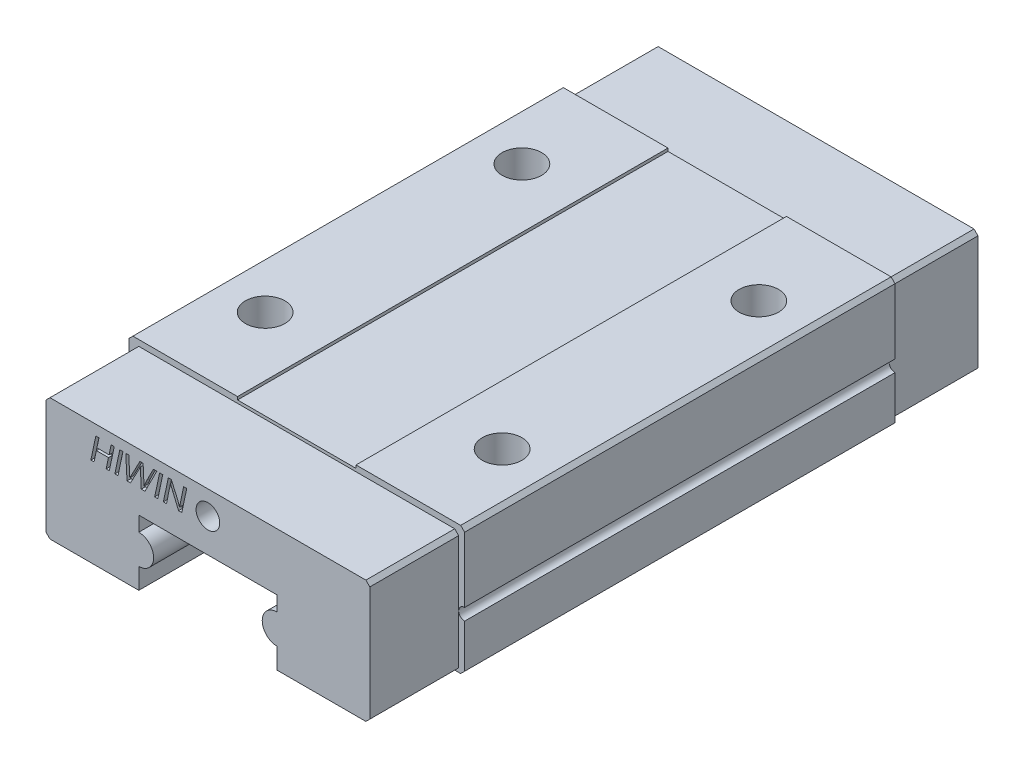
SolidWorks part; units mm, degrees
ref_plane "前视基准面" through (0, 0, 0) normal (0, 0, 1) x (1, 0, 0)
ref_plane "上视基准面" through (0, 0, 0) normal (0, 1, 0) x (1, 0, 0)
ref_plane "右视基准面" through (0, 0, 0) normal (1, 0, 0) x (0, 0, -1)
imported_body "输入2"
hole_wizard "M2 螺纹孔1" positions "草图2" profile "草图1" tap size "M2" standard "ISO"
sketch "草图2" plane through (0, 8, 0) normal (0, 1, 0) x (-1, 0, 0)
  point P1 (6, -6.5)
  point P4 (-6, -6.5)
  point P7 (-6, 6.5)
  point P10 (6, 6.5)
sketch "草图1" plane through (-6, 8, -6.5) normal (1, 0, 0) x (0, 0, 1)
  line L0 (0, 0) -> (0, 4.1807)
  line L1 (0, 4.1807) -> (0.8, 3.7)
  line L2 (0.8, 3.7) -> (0.8, 2.5)
  line L3 (0.8, 2.5) -> (1, 2.5)
  line L4 (1, 2.5) -> (1, 0)
  line L5 (1, 0) -> (0, 0)
  line L10 (0, 4.1807) -> (-0.8, 3.7) construction
  line L11 (0, -6.35) -> (0, 107.95) construction
  dimension "螺纹孔钻头直径" = 1.6
  dimension "螺纹孔钻头深度" = 3.7
  dimension "螺纹主直径" = 2
  dimension "螺纹深度" = 2.5
  dimension "导头角度" = 118
